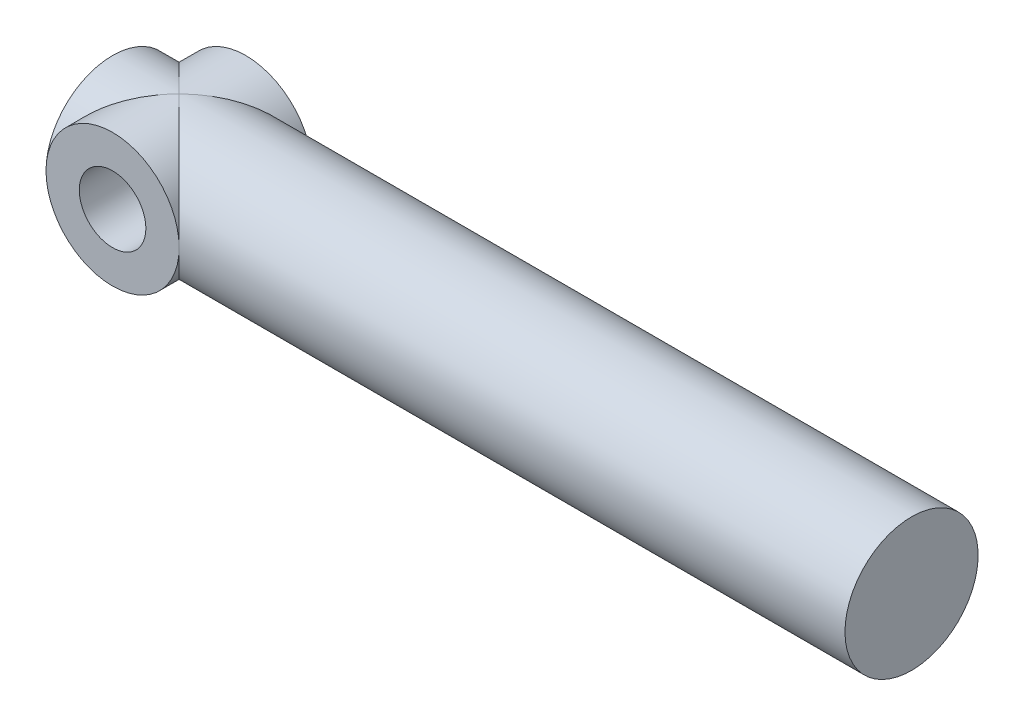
SolidWorks part; units mm, degrees
ref_plane "Front Plane" through (0, 0, 0) normal (0, 0, 1) x (1, 0, 0)
ref_plane "Top Plane" through (0, 0, 0) normal (0, 1, 0) x (1, 0, 0)
ref_plane "Right Plane" through (0, 0, 0) normal (1, 0, 0) x (0, 0, -1)
sketch "Sketch1" plane through (0, 0, 0) normal (0, 0, 1) x (1, 0, 0)
  line L0 (0, 0) -> (38.1, 0) construction
  line L1 (0, 0) -> (0, 3.175)
  line L2 (0, 3.175) -> (38.1, 3.175)
  line L3 (38.1, 3.175) -> (38.1, 0)
  line L6 (38.1, 0) -> (0, 0)
  dimension "D1" = 38.1
  dimension "D2" = 38.1
  dimension "D5" = 3.175
revolve "Revolve1" add sketch "Sketch1" angle 360 about L0
sketch "Sketch4" plane through (0, 0, 0) normal (0, 0, 1) x (1, 0, 0)
  circle A0 centre (3.175, 0) radius 1.5875
  dimension "D1" = 3.175
  dimension "D2" = 3.175
extrude "Cut-Extrude2" cut sketch "Sketch4" along normal mid plane 12.7
sketch "Sketch8" plane through (0, 0, 0) normal (0, 0, 1) x (1, 0, 0)
  circle A0 centre (3.175, 0) radius 3.175
  circle A1 centre (3.175, 0) radius 1.5875
  dimension "D1" = 6.35
  dimension "D2" = 3.175
extrude "Boss-Extrude2" add sketch "Sketch8" along normal mid plane 6.35
